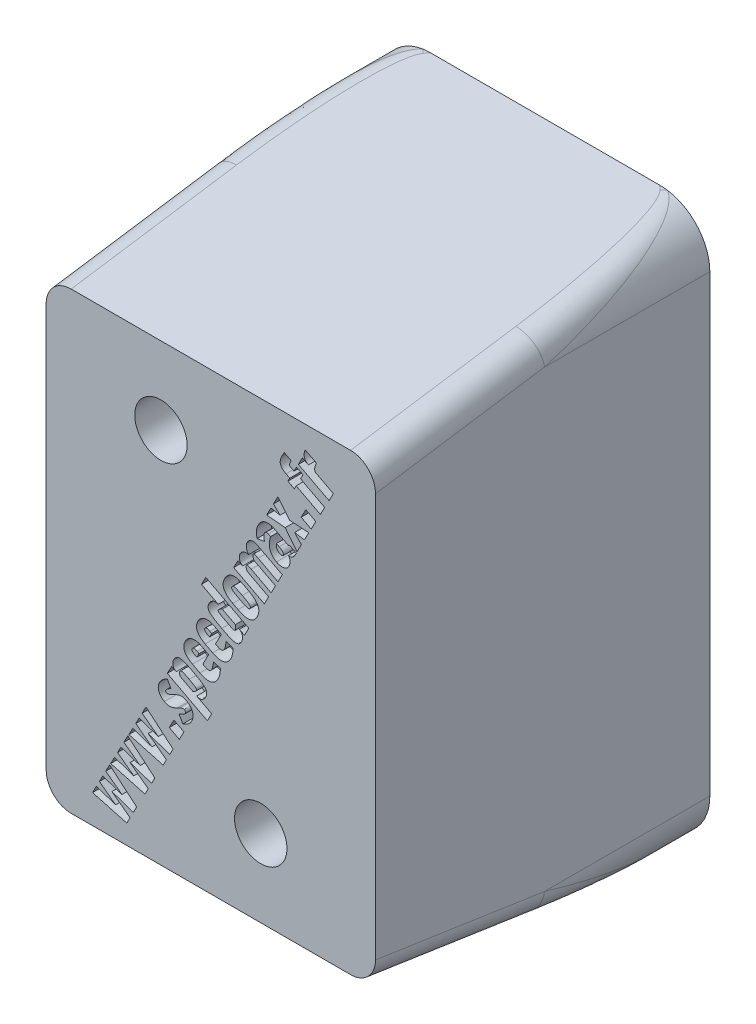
SolidWorks part; units mm, degrees
ref_plane "Face" through (0, 0, 0) normal (0, 0, 1) x (1, 0, 0)
ref_plane "Dessus" through (0, 0, 0) normal (0, 1, 0) x (1, 0, 0)
ref_plane "Droite" through (0, 0, 0) normal (1, 0, 0) x (0, 0, -1)
sketch "Esquisse1" plane through (0, 0, 0) normal (0, 0, 1) x (1, 0, 0)
  line L1 (-13, 25.5) -> (33, 25.5)
  line L2 (-23, 15.5) -> (-23, -75.5)
  line L3 (-13, -85.5) -> (33, -85.5)
  line L4 (43, 15.5) -> (43, -75.5)
  circle A1 centre (0, 0) radius 5.25
  circle A2 centre (20, -60) radius 5.25
  arc A4 (43, 15.5) -> (33, 25.5) centre (33, 15.5) ccw
  arc A5 (-23, 15.5) -> (-13, 25.5) centre (-13, 15.5) cw
  arc A6 (-13, -85.5) -> (-23, -75.5) centre (-13, -75.5) cw
  arc A7 (43, -75.5) -> (33, -85.5) centre (33, -75.5) cw
  point P13 (43, 25.5)
  point P16 (-23, 25.5)
  point P19 (-23, -85.5)
  dimension "D1" = 10.5
  dimension "D2" = 111
  dimension "D4" = 60
  dimension "D7" = 10
  dimension "D9" = 25.5
  dimension "D3" = 20
  dimension "D5" = 66
  dimension "D6" = 25.5
  dimension "D8" = 23
extrude "Extrusion1" add sketch "Esquisse1" along normal blind 67
sketch "Esquisse2" plane through (43, 0, 0) normal (1, 0, 0) x (0, 0, -1)
  line L0 (8.1017, 26.7092) -> (-71.0835, 14.8905)
  line L1 (-73.5433, -74.5234) -> (8.7421, -86.8048)
  line L2 (-67, -75.5) -> (-67, 15.5) construction
  spline_without_curve S0
  spline_without_curve S1
  point P6 (-67, -75.5)
  point P12 (-67, 15.5)
  dimension "D1" = 10
  dimension "D2" = 10
  dimension "D3" = 91
extrude "Enlèv. mat.-Extru.1" cut sketch "Esquisse2" against normal through all
fillet "Congé2" radius 5
sketch "Esquisse3" plane through (0, 0, 67) normal (0, 0, -1) x (-1, 0, 0)
  line L0 (-35.0885, 7.2302) -> (12.9334, -83.086) construction
  line L1 (13, -85.5) -> (-33, -85.5) construction
  text T0 "<b>www.speedomax.fr</b>" font "BellGothic Blk BT" height in points 36
  dimension "D1" = 62
extrude "Enlèv. mat.-Extru.2" cut sketch "Esquisse3" along normal blind 3
